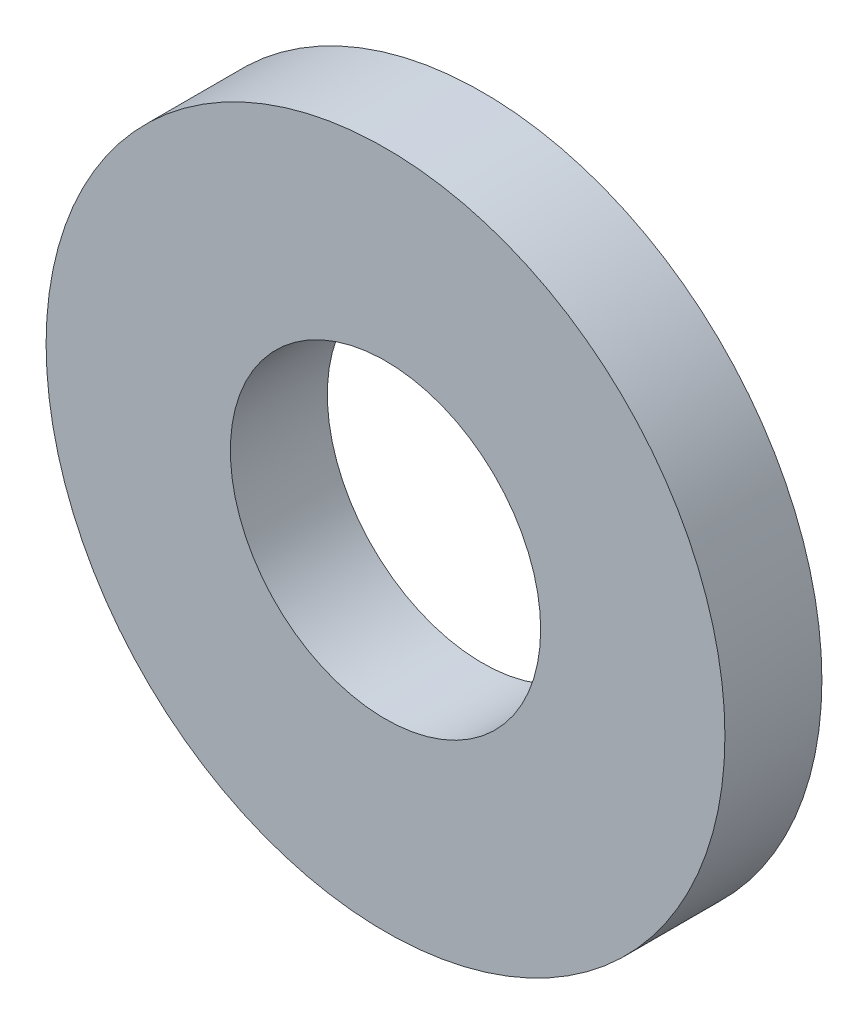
SolidWorks part; units mm, degrees
ref_plane "Front Plane" through (0, 0, 0) normal (0, 0, 1) x (1, 0, 0)
ref_plane "Top Plane" through (0, 0, 0) normal (0, 1, 0) x (1, 0, 0)
ref_plane "Right Plane" through (0, 0, 0) normal (1, 0, 0) x (0, 0, -1)
sketch "Sketch1" plane through (0, 0, 0) normal (0, 0, 1) x (1, 0, 0)
  circle A0 centre (0, 0) radius 3.5
  circle A1 centre (0, 0) radius 1.6
  dimension "OD" = 7
  dimension "ID1" = 3.2
extrude "Boss-Extrude1" add sketch "Sketch1" along normal blind 1
